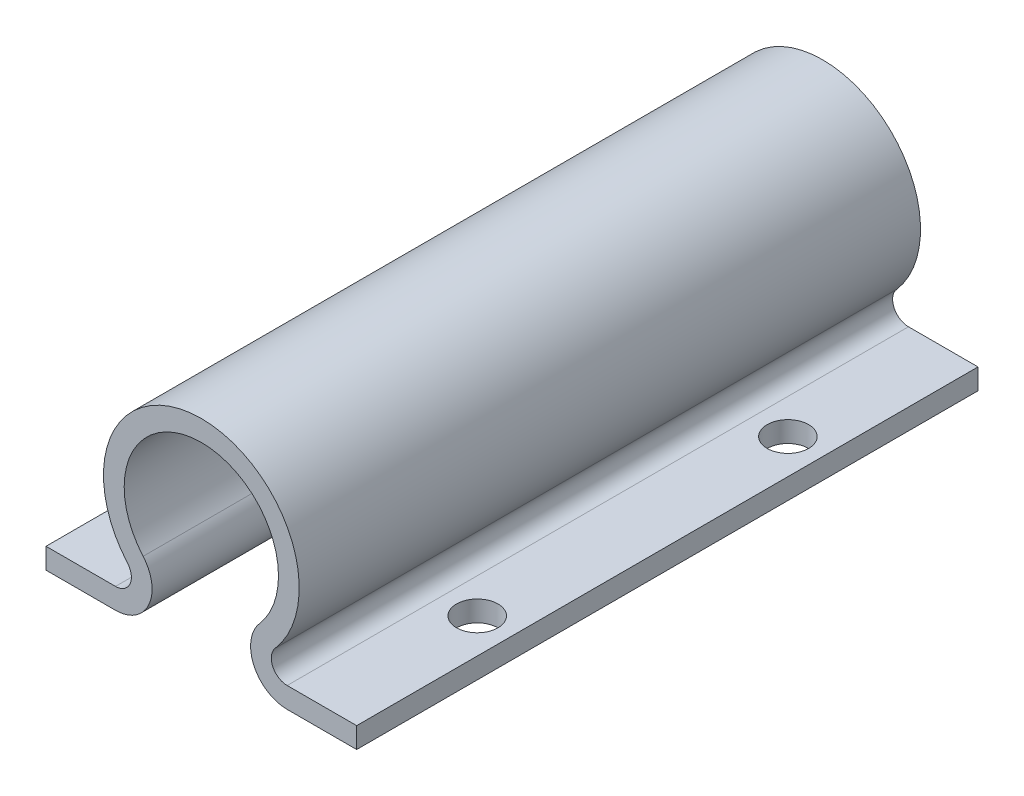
SolidWorks part; units mm, degrees
ref_plane "Front Plane" through (0, 0, 0) normal (0, 0, 1) x (1, 0, 0)
ref_plane "Top Plane" through (0, 0, 0) normal (0, 1, 0) x (1, 0, 0)
ref_plane "Right Plane" through (0, 0, 0) normal (1, 0, 0) x (0, 0, -1)
sketch "Sketch1" plane through (0, 0, 0) normal (0, 0, 1) x (1, 0, 0)
  line L0 (10.0024, 0) -> (18.5276, 0)
  line L1 (-0.5224, 38.1) -> (-0.5224, -3.8495) construction
  line L2 (-11.0472, 0) -> (-19.5724, 0)
  line L3 (10.0024, 2.54) -> (18.5276, 2.54)
  line L4 (-11.0472, 2.54) -> (-19.5724, 2.54)
  line L5 (-19.5724, 2.54) -> (-19.5724, 0)
  line L6 (18.5276, 2.54) -> (18.5276, 0)
  arc A0 (6.6176, 7.4285) -> (-7.6623, 7.4285) centre (-0.5224, 13.6367) ccw
  arc A1 (6.6176, 7.4285) -> (10.0024, 0) centre (10.0024, 4.4854) ccw
  arc A2 (-7.6623, 7.4285) -> (-11.0472, 0) centre (-11.0472, 4.4854) cw
  arc A3 (8.5343, 5.7619) -> (10.0024, 2.54) centre (10.0024, 4.4854) ccw
  arc A4 (8.5343, 5.7619) -> (-9.5791, 5.7619) centre (-0.5224, 13.6367) ccw
  arc A5 (-9.5791, 5.7619) -> (-11.0472, 2.54) centre (-11.0472, 4.4854) cw
  dimension "D1" = 9.4615
  dimension "D2" = 38.1
  dimension "D3" = 2.54
extrude "Boss-Extrude1" add sketch "Sketch1" along normal blind 76.2
sketch "Sketch2" plane through (0, 2.54, 0) normal (0, 1, 0) x (1, 0, 0)
  line L0 (14.265, 0) -> (14.265, -76.2) construction
  line L1 (18.5276, 0) -> (10.0024, 0) construction
  line L2 (18.5276, -76.2) -> (10.0024, -76.2) construction
  line L4 (-15.3098, 0) -> (14.265, 0) construction
  line L5 (-11.0472, 0) -> (-19.5724, 0) construction
  line L6 (-0.5224, 0) -> (-0.5224, -79.5229) construction
  circle A0 centre (14.265, -19.05) radius 2.54
  circle A1 centre (14.265, -57.15) radius 2.54
  circle A2 centre (-15.3098, -57.15) radius 2.54
  circle A3 centre (-15.3098, -19.05) radius 2.54
  dimension "D1" = 5.08
  dimension "D2" = 5.08
  dimension "D3" = 19.05
  dimension "D4" = 19.05
extrude "Cut-Extrude1" cut sketch "Sketch2" against normal blind 5.08
